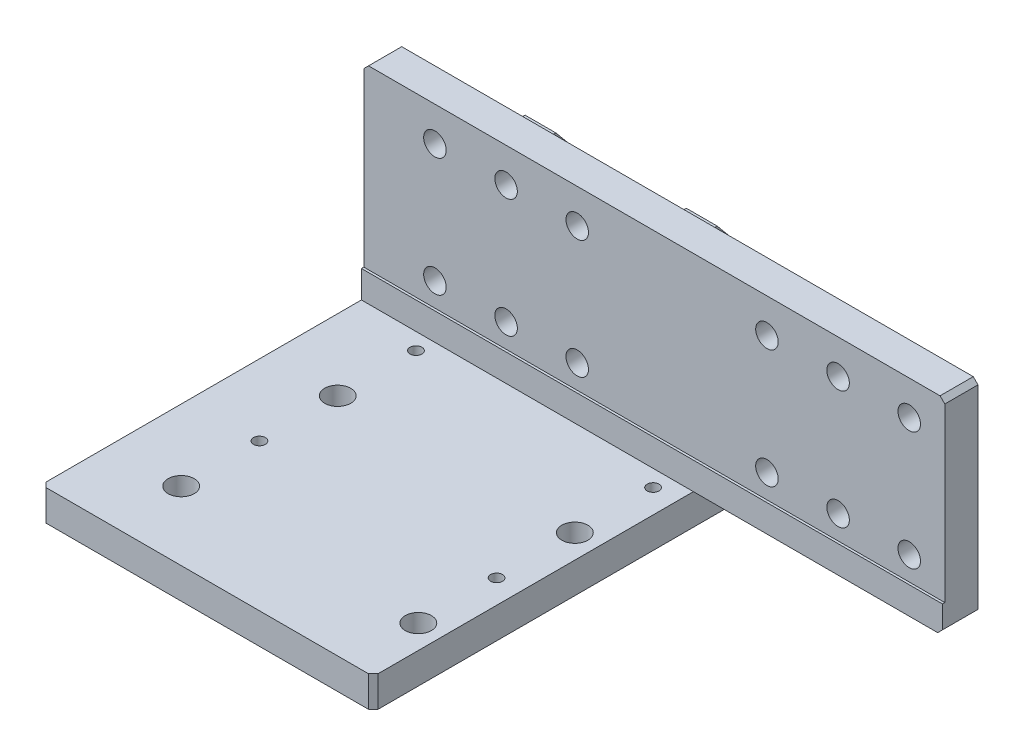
SolidWorks part; units mm, degrees
ref_plane "정면" through (0, 0, 0) normal (0, 0, 1) x (1, 0, 0)
ref_plane "윗면" through (0, 0, 0) normal (0, 1, 0) x (1, 0, 0)
ref_plane "우측면" through (0, 0, 0) normal (1, 0, 0) x (0, 0, -1)
sketch "스케치1" plane through (0, 0, 0) normal (0, 1, 0) x (1, 0, 0)
  line L1 (-70, 95) -> (70, 95)
  line L2 (-70, 95) -> (-70, -95)
  line L3 (-70, -95) -> (70, -95)
  line L4 (70, 95) -> (70, -95)
  line L5 (-70, 95) -> (70, -95) construction
  line L6 (-70, -95) -> (70, 95) construction
  point P0 (0, 0)
  dimension "D1" = 140
  dimension "D2" = 190
extrude "보스-돌출1" add sketch "스케치1" along normal blind 13
sketch "스케치2" plane through (0, 13, 0) normal (0, 1, 0) x (1, 0, 0)
  line L0 (-70, 95) -> (-70, -95) construction
  line L1 (-70, 55) -> (175, 55)
  line L2 (-70, 55) -> (-70, 40)
  line L3 (-70, 40) -> (175, 40)
  line L4 (175, 55) -> (175, 40)
  line L5 (70, 95) -> (-70, 95) construction
  dimension "D1" = 15
  dimension "D2" = 40
  dimension "D3" = 245
extrude "보스-돌출2" add sketch "스케치2" along normal blind 86 separate body
sketch "스케치14" plane through (0, 0, -40) normal (0, 0, 1) x (1, 0, 0)
  line L0 (175, 99) -> (175, 13) construction
  line L1 (-70, 99) -> (175, 99)
  line L2 (-70, 99) -> (-70, 24.5)
  line L3 (-70, 24.5) -> (175, 24.5)
  line L4 (175, 99) -> (175, 24.5)
  line L5 (-70, 13) -> (175, 13) construction
  dimension "D1" = 11.5
extrude "컷-돌출2" cut sketch "스케치14" against normal blind 1
sketch "스케치4" plane through (0, 13, 0) normal (0, 1, 0) x (1, 0, 0)
  line L0 (70, 95) -> (-70, 95) construction
  line L1 (-31, 95) -> (-18, 95)
  line L2 (-31, 95) -> (-31, 55)
  line L3 (-31, 55) -> (-18, 55)
  line L4 (-18, 95) -> (-18, 55)
  line L5 (175, 55) -> (-70, 55) construction
  line L6 (70, -95) -> (70, 95) construction
  line L7 (37, 95) -> (50, 95)
  line L8 (37, 95) -> (37, 55)
  line L9 (37, 55) -> (50, 55)
  line L10 (50, 95) -> (50, 55)
  point P14 (37, 75)
  dimension "D1" = 20
  dimension "D2" = 13
  dimension "D3" = 55
extrude "보스-돌출3" add sketch "스케치4" along normal blind 72 separate body
sketch "스케치5" plane through (50, 0, 0) normal (1, 0, 0) x (0, 0, -1)
  line L0 (95, 85) -> (95, 55)
  line L1 (95, 85) -> (95, 13) construction
  line L2 (95, 55) -> (70, 85)
  line L3 (55, 85) -> (95, 85) construction
  line L4 (70, 85) -> (95, 85)
  dimension "D1" = 25
  dimension "D2" = 30
extrude "컷-돌출1" cut sketch "스케치5" against normal through all
hole_wizard "M6 소켓 머리 캡 나사용 카운터보어1" positions "스케치6" profile "스케치7" counterbore size "M6" standard "KS"
sketch "스케치6" plane through (0, 13, 0) normal (0, 1, 0) x (1, 0, 0)
  line L1 (70, 95) -> (-70, 95) construction
  line L2 (70, -95) -> (70, 95) construction
  point P0 (-40, 66)
  point P2 (60, 66)
  point P17 (0, 0)
  point P18 (-40, 0)
  point P19 (-40, -66)
  point P20 (60, -66)
  point P21 (60, 0)
  dimension "D1" = 100
  dimension "D2" = 10
  dimension "D3" = 29
  dimension "D4" = 66
  dimension "D5" = 66
sketch "스케치7" plane through (-40, 13, -66) normal (1, 0, 0) x (0, 0, 1)
  line L0 (0, 0) -> (0, 13)
  line L1 (0, 13) -> (3.3, 13)
  line L3 (3.3, 13) -> (3.3, 8)
  line L4 (3.3, 8) -> (5.5, 8)
  line L5 (5.5, 8) -> (5.5, 0)
  line L7 (5.5, 0) -> (0, 0)
  line L11 (0, -6.35) -> (0, 107.95) construction
  dimension "관통 구멍 지름" = 6.6
  dimension "관통 구멍 깊이" = 13
  dimension "카운터보어 지름" = 11
  dimension "카운터보어 깊이" = 8
hole_wizard "Ø5.0mm 맞춤핀 구멍1" positions "스케치8" profile "스케치9" hole size "Ø5.0" standard "ISO"
sketch "스케치8" plane through (0, 13, 0) normal (0, 1, 0) x (1, 0, 0)
  line L0 (70, -95) -> (70, 95) construction
  line L1 (70, 95) -> (-70, 95) construction
  point P0 (-40, 33)
  point P2 (60, 33)
  point P4 (-40, -33)
  point P6 (60, -33)
  dimension "D1" = 10
  dimension "D2" = 100
  dimension "D3" = 62
  dimension "D4" = 66
sketch "스케치9" plane through (-40, 13, -33) normal (1, 0, 0) x (0, 0, 1)
  line L0 (0, 0) -> (0, 13)
  line L1 (0, 13) -> (2.5, 13)
  line L2 (2.5, 13) -> (2.5, 0)
  line L5 (2.5, 0) -> (0, 0)
  line L11 (0, -6.35) -> (0, 107.95) construction
  dimension "관통 구멍 지름" = 5
  dimension "관통 구멍 깊이" = 13
hole_wizard "구멍3" positions "스케치15" profile "스케치16" legacy
sketch "스케치15" plane through (0, 0, -41) normal (0, 0, 1) x (1, 0, 0)
  line L0 (-70, 13) -> (175, 13) construction
  line L2 (-70, 99) -> (-70, 24.5) construction
  point P0 (-40, 84.5)
  point P2 (-10, 84.5)
  point P4 (-40, 34.5)
  point P6 (-10, 34.5)
  point P8 (20, 34.5)
  point P10 (20, 84.5)
  dimension "D1" = 21.5
  dimension "D2" = 50
  dimension "D3" = 30
  dimension "D4" = 30
  dimension "D5" = 30
sketch "스케치16" plane through (-40, 84.5, -41) normal (1, 0, 0) x (0, -1, 0)
  line L0 (0, 0) -> (0, 55.6524)
  line L1 (0, 55.6524) -> (2.75, 54)
  line L2 (2.75, 54) -> (2.75, 8)
  line L3 (2.75, 8) -> (4.75, 8)
  line L4 (4.75, 0) -> (0, 0)
  line L5 (0, -11.3109) -> (0, 121.1557) construction
  line L6 (0, 55.6524) -> (-2.75, 54) construction
  line L7 (4.75, 8) -> (4.75, 0)
  dimension "지름" = 5.5
  dimension "깊이" = 54
  dimension "카운터-보어 지름" = 9.5
  dimension "카운터-보어 깊이" = 8
  dimension "드릴 각도" = 118
pattern_linear "선형 패턴2" count 2 spacing 140 along (1, 0, 0) of "구멍3"
chamfer "모따기3" distance 2 angle 45 3 edges at (175, 13, -47.5) (175, 99, -48) (-70, 99, -48)
chamfer "모따기4" distance 2 angle 45 4 edges at (-70, 6.5, -95) (70, 6.5, -95) (70, 6.5, 95) (-70, 6.5, 95)
